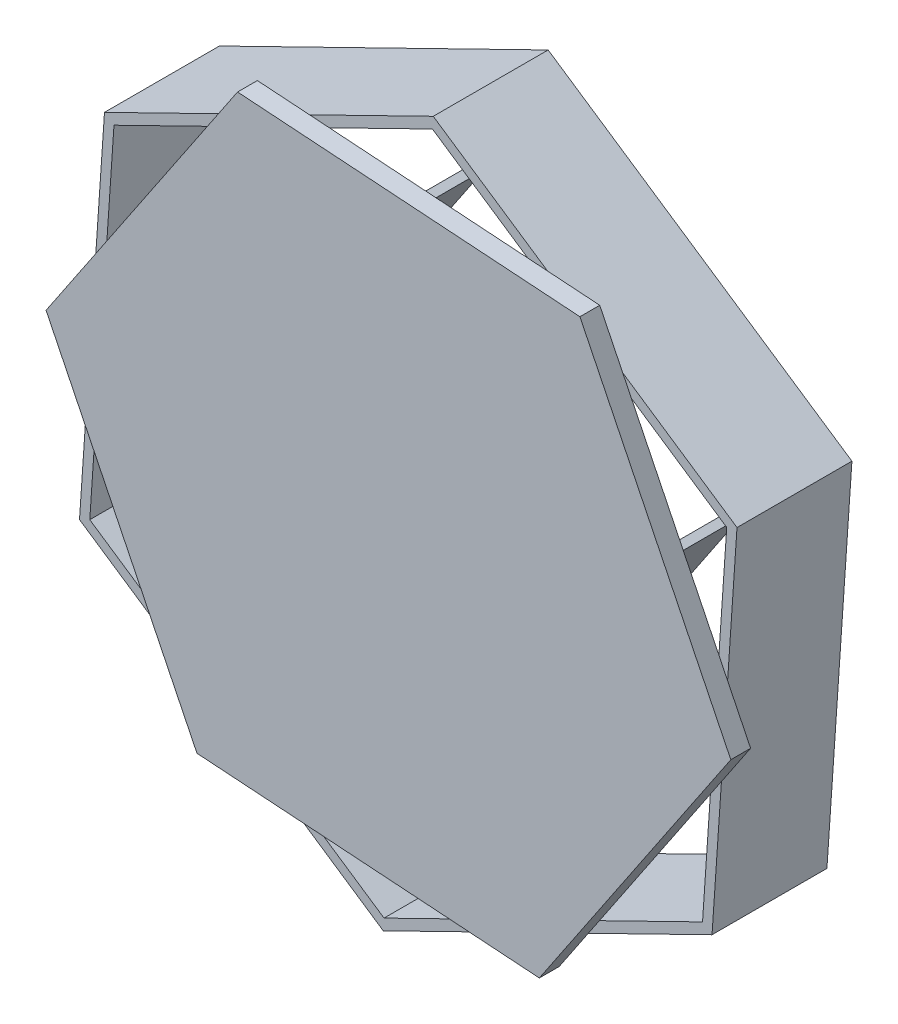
SolidWorks part; units mm, degrees
ref_plane "Front Plane" through (0, 0, 0) normal (0, 0, 1) x (1, 0, 0)
ref_plane "Top Plane" through (0, 0, 0) normal (0, 1, 0) x (1, 0, 0)
ref_plane "Right Plane" through (0, 0, 0) normal (1, 0, 0) x (0, 0, -1)
sketch "Sketch2" plane through (0, 0, 0) normal (0, 0, 1) x (1, 0, 0)
  line L1 (61.367, 91.2735) -> (-48.3616, 98.7821)
  line L2 (-48.3616, 98.7821) -> (-109.7286, 7.5086)
  line L3 (-109.7286, 7.5086) -> (-61.367, -91.2735)
  line L4 (-61.367, -91.2735) -> (48.3616, -98.7821)
  line L5 (48.3616, -98.7821) -> (109.7286, -7.5086)
  line L6 (109.7286, -7.5086) -> (61.367, 91.2735)
  circle A0 centre (0, 0) radius 95.25 construction
  dimension "D1" = 190.5
extrude "Boss-Extrude1" add sketch "Sketch2" against normal blind 6.35
sketch "Sketch3" plane through (0, 0, -6.35) normal (0, 0, -1) x (-1, 0, 0)
  line L1 (97.3583, 65.4581) -> (-8.0092, 117.0439)
  line L2 (-8.0092, 117.0439) -> (-105.3676, 51.5857)
  line L3 (-105.3676, 51.5857) -> (-97.3583, -65.4581)
  line L4 (-97.3583, -65.4581) -> (8.0092, -117.0439)
  line L5 (8.0092, -117.0439) -> (105.3676, -51.5857)
  line L6 (105.3676, -51.5857) -> (97.3583, 65.4581)
  line L7 (94.3159, 63.4126) -> (-7.7589, 113.3862)
  line L8 (-7.7589, 113.3862) -> (-102.0748, 49.9737)
  line L9 (-102.0748, 49.9737) -> (-94.3159, -63.4126)
  line L10 (-94.3159, -63.4126) -> (7.7589, -113.3862)
  line L11 (7.7589, -113.3862) -> (102.0748, -49.9737)
  line L12 (102.0748, -49.9737) -> (94.3159, 63.4126)
  circle A0 centre (0, 0) radius 101.6 construction
  circle A1 centre (0, 0) radius 98.425 construction
  dimension "D1" = 203.2
  dimension "D2" = 196.85
extrude "Boss-Extrude2" add sketch "Sketch3" along normal blind 36.83
sketch "Sketch5" plane through (0, 0, -43.18) normal (0, 0, -1) x (-1, 0, 0)
  line L1 (95.8371, 64.4353) -> (-7.8841, 115.2151)
  line L2 (-7.8841, 115.2151) -> (-103.7212, 50.7797)
  line L3 (-103.7212, 50.7797) -> (-95.8371, -64.4353)
  line L4 (-95.8371, -64.4353) -> (7.8841, -115.2151)
  line L5 (7.8841, -115.2151) -> (103.7212, -50.7797)
  line L6 (103.7212, -50.7797) -> (95.8371, 64.4353)
  circle A0 centre (0, 0) radius 100.0125 construction
  circle A1 centre (43.9765, 89.8252) radius 1.27
  circle A2 centre (99.7792, 6.8278) radius 1.27
  circle A3 centre (55.8026, -82.9974) radius 1.27
  circle A4 centre (-43.9765, -89.8252) radius 1.27
  circle A5 centre (-99.7792, -6.8278) radius 1.27
  circle A6 centre (-55.8026, 82.9974) radius 1.27
  dimension "D1" = 200.025
  dimension "D2" = 2.54
  dimension "D3" = 2.54
  dimension "D4" = 2.54
  dimension "D5" = 2.54
  dimension "D6" = 2.54
  dimension "D7" = 2.54
extrude "Cut-Extrude1" cut sketch "Sketch5" against normal blind 12.7 contours A6 | A5 | A4 | A3 | A2 | A1
sketch "Sketch6" plane through (0, 0, -6.35) normal (0, 0, -1) x (-1, 0, 0)
  line L0 (-3.1841, -86.3106) -> (-1.0763, -84.8934)
  line L1 (79.0228, -31.0394) -> (81.1307, -29.6222)
  line L2 (37.9193, -58.675) -> (-40.0272, 57.2578)
  line L3 (-40.0272, 57.2578) -> (-37.9193, 58.675)
  line L4 (-37.9193, 58.675) -> (40.0272, -57.2578)
  line L5 (79.0228, -31.0394) -> (1.0763, 84.8934)
  line L9 (1.0763, 84.8934) -> (3.1841, 86.3106)
  line L10 (3.1841, 86.3106) -> (81.1307, -29.6222)
  line L13 (-3.1841, -86.3106) -> (-81.1307, 29.6222)
  line L14 (-81.1307, 29.6222) -> (-79.0228, 31.0394)
  line L15 (-79.0228, 31.0394) -> (-1.0763, -84.8934)
  line L16 (37.9193, -58.675) -> (40.0272, -57.2578)
  line L18 (-61.2618, -79.5951) -> (-96.8284, -26.6956) construction
  line L19 (61.2618, 79.5951) -> (96.8284, 26.6956) construction
  line L20 (-7.7589, 113.3862) -> (-102.0748, 49.9737) construction
  line L21 (38.3005, -92.8519) -> (71.5333, -70.5081) construction
  line L22 (-38.3005, 92.8519) -> (-71.5333, 70.5081) construction
  point P0 (-40.0495, -26.927)
  dimension "D1" = 46.99
  dimension "D2" = 46.99
  dimension "D3" = 2.54
  dimension "D4" = 2.54
  dimension "D5" = 2.54
  dimension "D6" = 139.7
  dimension "D7" = 44.45
  dimension "D8" = 28.575
extrude "Boss-Extrude4" add sketch "Sketch6" along normal blind 25.4
